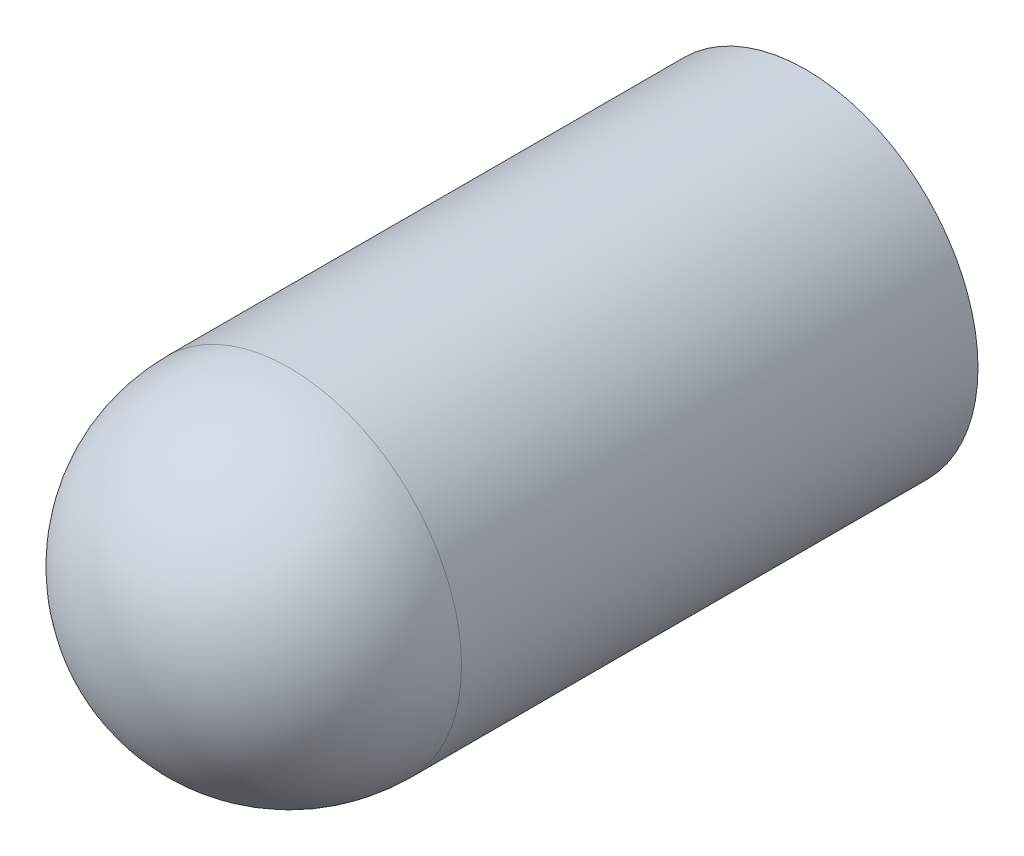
SolidWorks part; units mm, degrees
ref_plane "Front Plane" through (0, 0, 0) normal (0, 0, 1) x (1, 0, 0)
ref_plane "Top Plane" through (0, 0, 0) normal (0, 1, 0) x (1, 0, 0)
ref_plane "Right Plane" through (0, 0, 0) normal (1, 0, 0) x (0, 0, -1)
sketch "Sketch1" plane through (0, 0, 0) normal (0, 0, 1) x (1, 0, 0)
  circle A0 centre (0, 0) radius 10
  dimension "D1" = 20
extrude "Extrude1" add sketch "Sketch1" along normal blind 40
fillet "Fillet1" radius 10 1 edges at (10, 0, 40)
